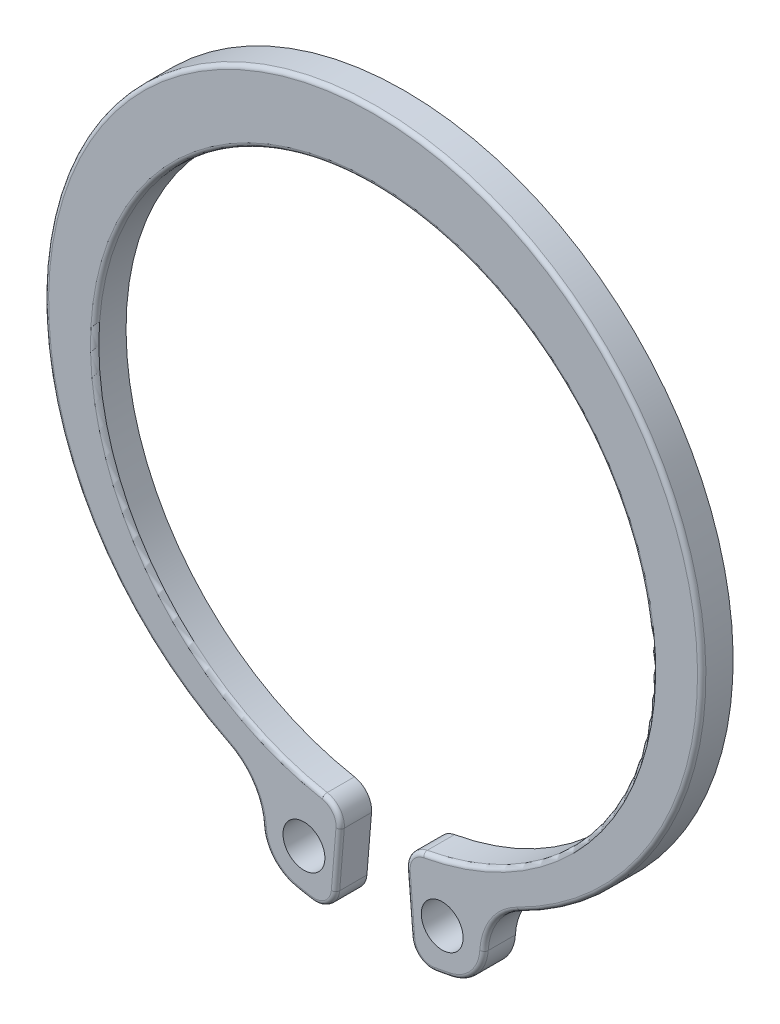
SolidWorks part; units mm, degrees
ref_plane "Face" through (0, 0, 0) normal (0, 0, 1) x (1, 0, 0)
ref_plane "Dessus" through (0, 0, 0) normal (0, 1, 0) x (1, 0, 0)
ref_plane "Droite" through (0, 0, 0) normal (1, 0, 0) x (0, 0, -1)
sketch "Esquisse1" plane through (0, 0, 0) normal (0, 0, 1) x (1, 0, 0)
  line L0 (0, 16.5) -> (0, 13.3) construction
  line L1 (1.4964, -13.2155) -> (1.8808, -17.8998)
  line L2 (-1.4964, -13.2155) -> (-1.8808, -17.8998)
  line L3 (0.4, -12.9438) -> (0.4, -17.6438) construction
  line L4 (-0.4, -12.9438) -> (-0.4, -17.6438) construction
  arc A0 (1.4964, -13.2155) -> (-1.4964, -13.2155) centre (0, 0) ccw
  arc A1 (6.9621, -13.2719) -> (-6.9621, -13.2719) centre (0, 0.8) ccw
  arc A2 (1.8808, -17.8998) -> (3.7147, -17.6108) centre (0, 0) ccw
  circle A3 centre (3.3019, -15.6539) radius 1
  arc A4 (3.7147, -17.6108) -> (5.2981, -15.7767) centre (3.3019, -15.6539) ccw
  arc A5 (6.9621, -13.2719) -> (5.2981, -15.7767) centre (8.2924, -15.9608) ccw
  circle A6 centre (-3.3019, -15.6539) radius 1
  arc A7 (-6.9621, -13.2719) -> (-5.2981, -15.7767) centre (-8.2924, -15.9608) cw
  arc A8 (-3.7147, -17.6108) -> (-5.2981, -15.7767) centre (-3.3019, -15.6539) cw
  arc A9 (-1.8808, -17.8998) -> (-3.7147, -17.6108) centre (0, 0) cw
  arc A10 (0.4, -12.9438) -> (-0.4, -12.9438) centre (0, 0) ccw construction
  circle A11 centre (0, 0) radius 14 construction
  dimension "dgorge" = 26.6
  dimension "D3" = 0.8
  dimension "dtrou" = 2
  dimension "D8" = 2
  dimension "D9" = 3
  dimension "dint" = 25.9
  dimension "dn" = 28
  dimension "b" = 3.2
  dimension "a" = 4.7
  dimension "D5" = 12.921
  dimension "D7" = 1.6
  dimension "D12" = 0.8
  dimension "D13" = 3.54
  dimension "D14" = 4.69
extrude "Base-Extrusion" add sketch "Esquisse1" along normal blind 1.5
fillet "Congé1" radius 1 4 edges at (1.8808, -17.8998, 0.75) (-1.8808, -17.8998, 0.75) (1.4964, -13.2155, 0.75) (-1.4964, -13.2155, 0.75)
fillet "Congé2" radius 0.2 14 edges at (-1.7761, -13.4588, 1.5) (-1.6838, -15.4992, 1.5) (-2.1765, -17.5564, 1.5) (-3.3358, -17.6865, 1.5) (-4.8158, -16.9609, 1.5) (-5.7936, -14.3008, 1.5) (0, 16.5, 1.5) (5.7936, -14.3008, 1.5) (4.8158, -16.9609, 1.5) (3.3358, -17.6865, 1.5) (2.1765, -17.5564, 1.5) (1.6838, -15.4992, 1.5) (1.7761, -13.4588, 1.5) (0, 13.3, 1.5)
equation "\"D3@Esquisse1\" = \"b@Esquisse1\"/4"
equation "\"D7@Esquisse1\"=\"dtrou@Esquisse1\"*0.8"
equation "\"D8@Esquisse1\" = \"dtrou@Esquisse1\""
equation "\"D9@Esquisse1\" = \"dtrou@Esquisse1\"*1.5"
equation "\"D12@Esquisse1\" = \"dtrou@Esquisse1\"*0.4"
equation "\"D5@Esquisse1\" = 360-(360-\"D13@Esquisse1\")*\"dint@Esquisse1\"/\"dgorge@Esquisse1\""
equation "\"D14@Esquisse1\" = (\"D5@Esquisse1\"-\"D13@Esquisse1\")/2"
